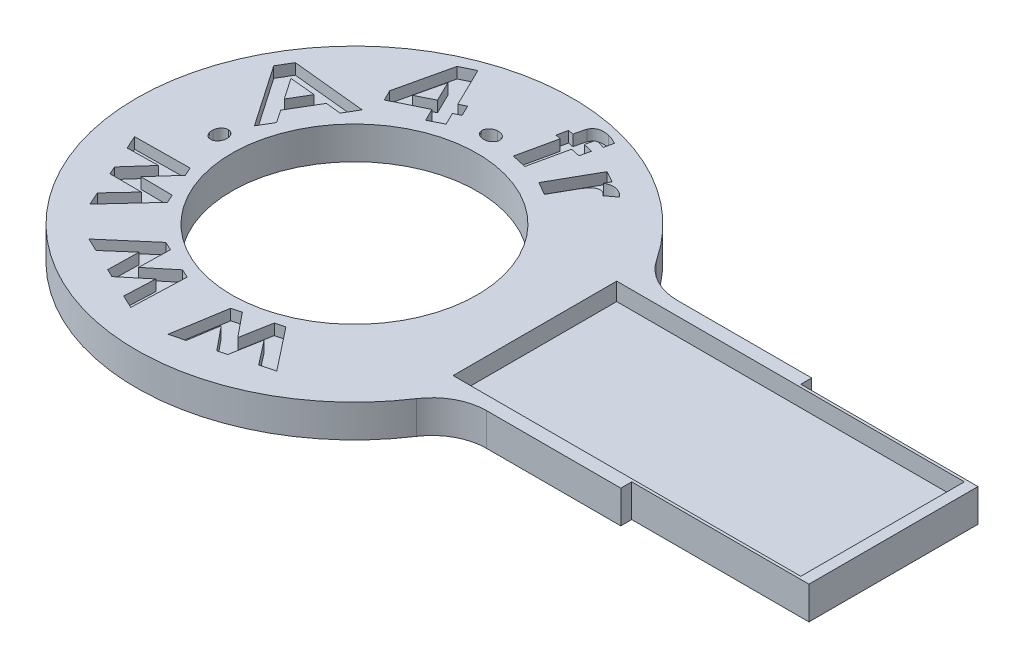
SolidWorks part; units mm, degrees
ref_plane "Plan de face" through (0, 0, 0) normal (0, 0, 1) x (1, 0, 0)
ref_plane "Plan de dessus" through (0, 0, 0) normal (0, 1, 0) x (1, 0, 0)
ref_plane "Plan de droite" through (0, 0, 0) normal (1, 0, 0) x (0, 0, -1)
sketch "Esquisse1" plane through (0, 0, 0) normal (0, 1, 0) x (1, 0, 0)
  line L0 (-65.3221, 0) -> (85.4006, 0) construction
  line L1 (0, 35.8736) -> (0, -40.6924) construction
  line L2 (-1.5, 11.7069) -> (-1.5, -9.2007) construction
  line L3 (-25, 6.2) -> (25, 6.2) construction
  line L4 (-25, 6.2) -> (-25, -6.2) construction
  line L5 (-25, -6.2) -> (25, -6.2) construction
  line L6 (25, 6.2) -> (25, -6.2)
  line L7 (-25, 6.2) -> (25, -6.2) construction
  line L8 (-25, -6.2) -> (25, 6.2) construction
  line L9 (12, 6.2) -> (12, 7)
  line L10 (12, -6.2) -> (25, -6.2)
  line L11 (12, 6.2) -> (25, 6.2)
  line L12 (-0.1506, -7) -> (12, -7)
  line L14 (-0.1506, 7) -> (12, 7)
  line L15 (12, -7) -> (12, -6.2)
  line L16 (-19.5995, -7) -> (12, 7) construction
  line L17 (-19.5995, 7) -> (12, -7) construction
  arc A0 (-3.5385, 7) -> (-3.5385, -7) centre (-14.5381, 0) ccw construction
  arc A1 (-0.1506, 7) -> (-0.1506, -7) centre (-14.5381, 0) ccw
  point P5 (0, 0)
  point P14 (-3.7998, 0)
  dimension "D4" = 13
  dimension "D1" = 12.4
  dimension "D2" = 50
  dimension "D3" = 1.5
  dimension "D5" = 14
extrude "Boss.-Extru.1" add sketch "Esquisse1" against normal blind 2.4
sketch "Esquisse2" plane through (0, 0, 0) normal (0, 1, 0) x (1, 0, 0)
  line L1 (-1.3, 6) -> (24.2, 6)
  line L2 (-1.3, 6) -> (-1.3, -6)
  line L3 (-1.3, -6) -> (24.2, -6)
  line L4 (24.2, 6) -> (24.2, -6)
  line L6 (25, -6.2) -> (25, 6.2) construction
  line L7 (0, 0) -> (0, 9.6803) construction
  line L8 (-2.3, 10.2545) -> (-2.3, -8.4238) construction
  line L9 (12, -6.2) -> (25, -6.2) construction
  line L10 (25, 6.2) -> (-3.0685, 6.2) construction
  dimension "D1" = 12
  dimension "D2" = 0.2
  dimension "D3" = 0.2
  dimension "D4" = 0.8
  dimension "D5" = 25.5
  dimension "D6" = 1
  dimension "D7" = 2.3
extrude "Enlèv. mat.-Extru.1" cut sketch "Esquisse2" against normal blind 1.3
sketch "Esquisse3" plane through (0, 0, 0) normal (0, 1, 0) x (1, 0, 0)
  circle A0 centre (-14.5381, 0) radius 9
extrude "Enlèv. mat.-Extru.2" cut sketch "Esquisse3" against normal through all
sketch "Esquisse4" plane through (0, 0, 0) normal (0, 1, 0) x (1, 0, 0)
  line L0 (-14.5381, 0) -> (-3.3986, 4.2924) construction
  line L1 (-14.5381, 0) -> (-3.8564, -0.7927) construction
  arc A0 (-4.9269, 3.7035) -> (-4.2663, -0.7623) centre (-14.5381, 0) ccw construction
  text T0 "www.A4.fr  " font "Century Gothic" height 5
extrude "Enlèv. mat.-Extru.3" cut sketch "Esquisse4" against normal blind 0.8
fillet "Congé1" radius 4 2 edges at (-0.1506, -1.2, 7) (-0.1506, -1.2, -7)
